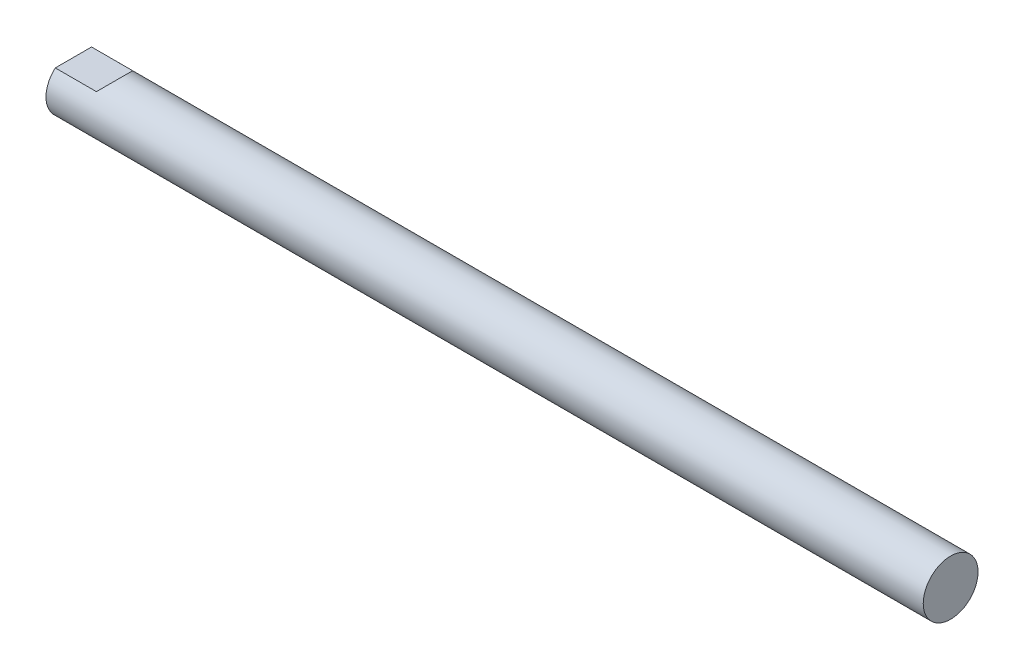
SolidWorks part; units mm, degrees
ref_plane "Front Plane" through (0, 0, 0) normal (0, 0, 1) x (1, 0, 0)
ref_plane "Top Plane" through (0, 0, 0) normal (0, 1, 0) x (1, 0, 0)
ref_plane "Right Plane" through (0, 0, 0) normal (1, 0, 0) x (0, 0, -1)
sketch "Sketch1" plane through (0, 0, 0) normal (0, 0, 1) x (1, 0, 0)
  line L0 (0, 0) -> (0, 12.7)
  line L1 (0, 12.7) -> (406.4, 12.7)
  line L2 (406.4, 12.7) -> (406.4, 0)
  line L3 (406.4, 0) -> (0, 0)
  line L4 (-29.8622, 0) -> (246.4486, 0) construction
  dimension "D1" = 25.4
  dimension "D2" = 406.4
revolve "Revolve1" add sketch "Sketch1" angle 360 about L4
hole_wizard "1/2-13 Tapped Hole1" positions "Sketch3" profile "Sketch2" tap size "1/2-13" standard "ANSI Inch"
sketch "Sketch3" plane through (0, 0, 0) normal (-1, 0, 0) x (0, 0, 1)
  point P0 (0, 0)
sketch "Sketch2" plane through (0, 0, 0) normal (0, 1, 0) x (0, 0, 1)
  line L0 (0, 0) -> (0, 38.3985)
  line L1 (0, 38.3985) -> (5.3581, 35.179)
  line L2 (5.3581, 35.179) -> (5.3581, 0)
  line L5 (5.3581, 0) -> (0, 0)
  line L10 (0, 38.3985) -> (-5.3581, 35.179) construction
  line L11 (0, -6.35) -> (0, 107.95) construction
  dimension "Tap Drill Dia." = 10.7163
  dimension "Tap Drill Depth" = 35.179
  dimension "Drill Angle" = 118
sketch "Sketch4" plane through (0, 0, 0) normal (0, 0, 1) x (1, 0, 0)
  line L0 (0, 9.525) -> (19.05, 9.525)
  line L1 (0, 12.7) -> (0, -12.7) construction
  line L2 (19.05, 9.525) -> (22.225, 12.7)
  line L3 (406.4, 12.7) -> (0, 12.7) construction
  line L4 (22.225, 12.7) -> (0, 12.7)
  line L5 (0, 12.7) -> (0, 9.525)
  line L6 (-5.7422, 0) -> (50.3718, 0) construction
  line L7 (0, -12.7) -> (406.4, -12.7) construction
  dimension "D1" = 22.225
  dimension "D2" = 45
  dimension "D3" = 19.05
extrude "Cut-Extrude1" cut sketch "Sketch4" against normal through all both and the other way through all
